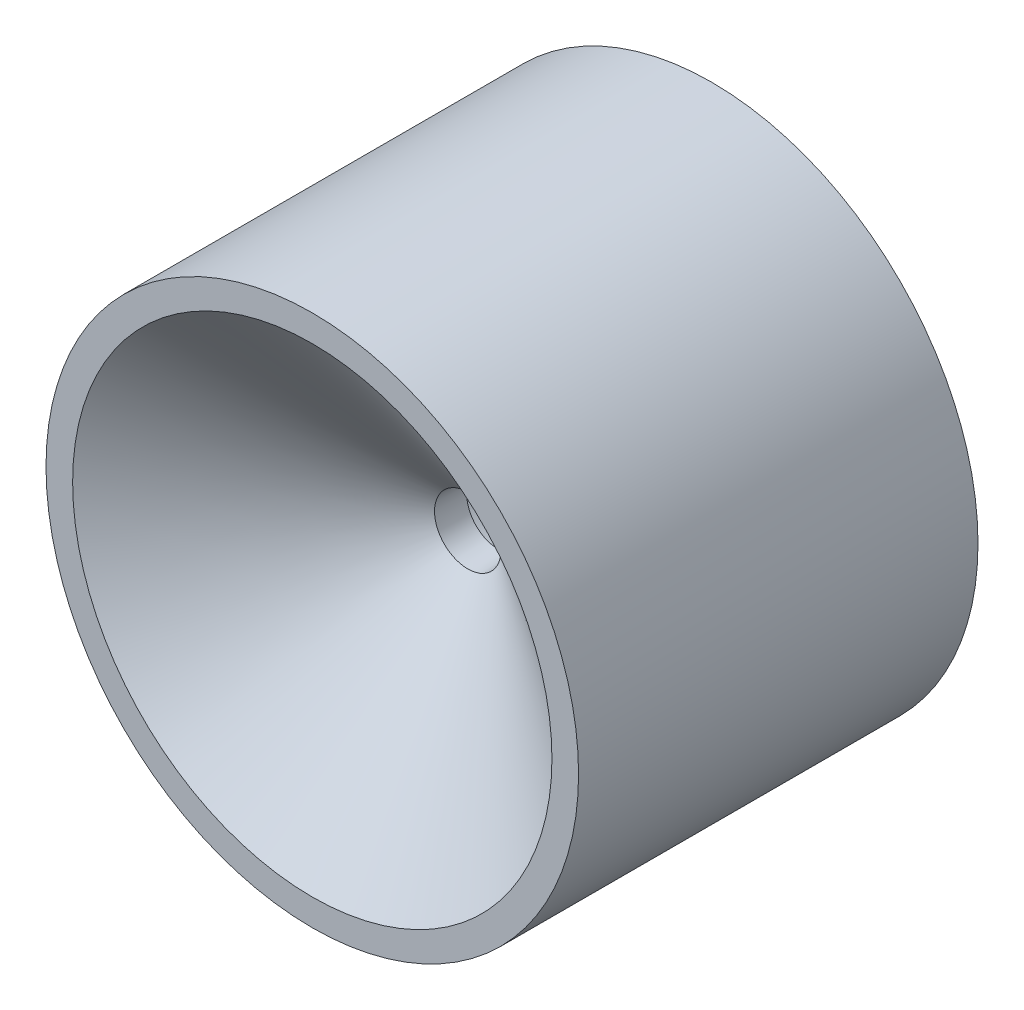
SolidWorks part; units mm, degrees
ref_plane "Plan de face" through (0, 0, 0) normal (0, 0, 1) x (1, 0, 0)
ref_plane "Plan de dessus" through (0, 0, 0) normal (0, 1, 0) x (1, 0, 0)
ref_plane "Plan de droite" through (0, 0, 0) normal (1, 0, 0) x (0, 0, -1)
sketch "Esquisse1" plane through (0, 0, 0) normal (0, 0, 1) x (1, 0, 0)
  circle A0 centre (0, 0) radius 10
  dimension "D1" = 20
extrude "Boss.-Extru.1" add sketch "Esquisse1" along normal blind 15
sketch "Esquisse2" plane through (0, 0, 0) normal (0, 0, 1) x (1, 0, 0)
  circle A0 centre (0, 0) radius 3.4
  dimension "D1" = 6.8
extrude "Enlèv. mat.-Extru.1" cut sketch "Esquisse2" along normal blind 8
sketch "Esquisse3" plane through (0, 0, 8) normal (0, 0, -1) x (-1, 0, 0)
  circle A0 centre (0, 0) radius 1.2
  dimension "D1" = 2.4
extrude "Enlèv. mat.-Extru.2" cut sketch "Esquisse3" against normal through all draft 2.45
sketch "Esquisse5" plane through (0, 0, 15) normal (0, 0, 1) x (1, 0, 0)
  circle A0 centre (0, 0) radius 9
  dimension "D1" = 18
extrude "Enlèv. mat.-Extru.3" cut sketch "Esquisse5" against normal blind 6 draft 53
sketch "Esquisse6" plane through (0, 0, 0) normal (0, 0, -1) x (-1, 0, 0)
  circle A0 centre (0, 0) radius 9
  circle A1 centre (0, 0) radius 5.5
  dimension "D1" = 18
  dimension "D2" = 11
extrude "Enlèv. mat.-Extru.4" cut sketch "Esquisse6" against normal blind 11.5
